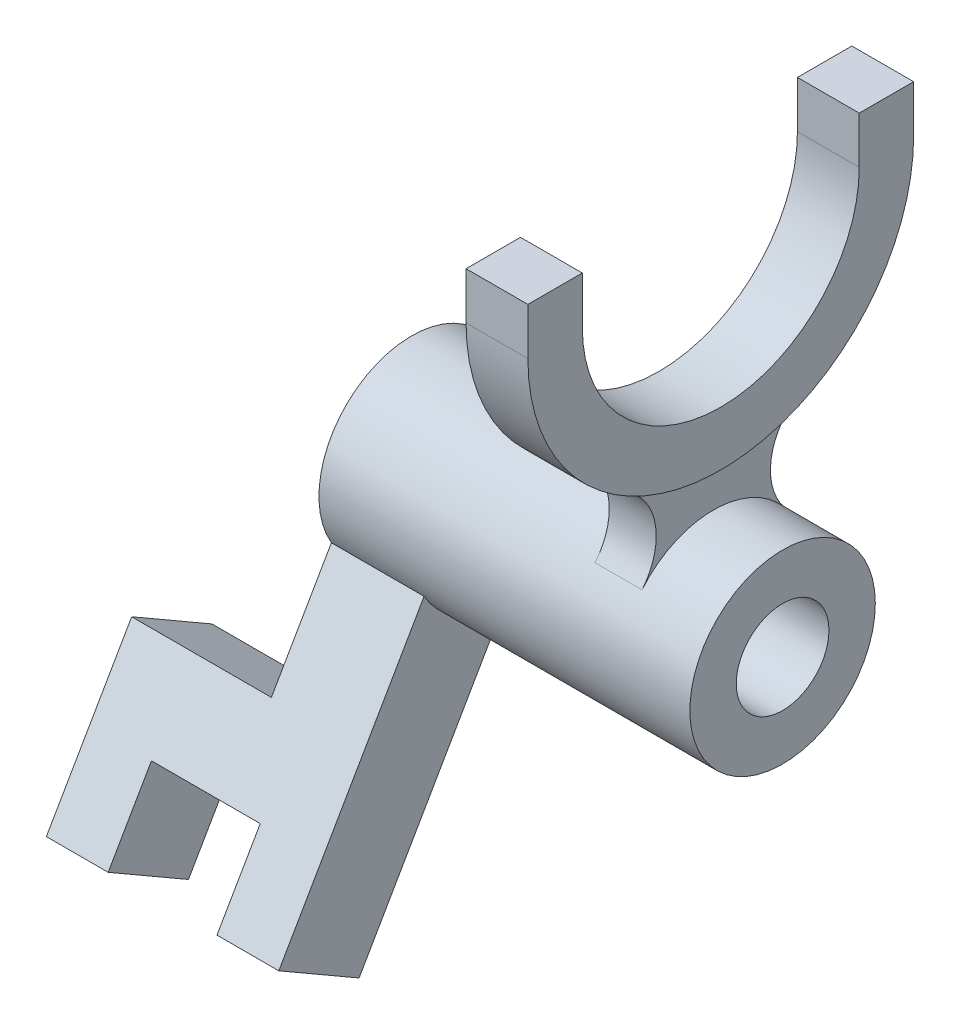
SolidWorks part; units mm, degrees
ref_plane "Front Plane" through (0, 0, 0) normal (0, 0, 1) x (1, 0, 0)
ref_plane "Top Plane" through (0, 0, 0) normal (0, 1, 0) x (1, 0, 0)
ref_plane "Right Plane" through (0, 0, 0) normal (1, 0, 0) x (0, 0, -1)
sketch "Sketch1" plane through (0, 0, 0) normal (1, 0, 0) x (0, 0, -1)
  circle A0 centre (0, 0) radius 9.525
  circle A1 centre (0, 0) radius 19.05
  dimension "D1" = 38.1
  dimension "D2" = 19.05
extrude "Boss-Extrude2" add sketch "Sketch1" along normal blind 19.05 and the other way blind 57.15
sketch "Sketch3" plane through (0, 0, 0) normal (1, 0, 0) x (0, 0, -1)
  line L0 (0, 0) -> (0, 66.548) construction
  line L1 (39.624, 66.548) -> (39.624, 76.2)
  line L2 (-39.624, 66.548) -> (-39.624, 76.2)
  arc A0 (-39.624, 66.548) -> (39.624, 66.548) centre (0, 66.548) ccw
  dimension "D2" = 39.624
  dimension "D1" = 66.548
  dimension "D3" = 9.652
extrude "Extrude-Thin1" add sketch "Sketch3" along normal mid plane 12.7 separate body thin
sketch "Sketch4" plane through (0, 0, 0) normal (1, 0, 0) x (0, 0, -1)
  arc A0 (-39.624, 66.548) -> (39.624, 66.548) centre (0, 66.548) ccw construction
  circle A1 centre (0, 0) radius 19.05 construction
  arc A2 (-18.5011, 31.5085) -> (18.5011, 31.5085) centre (0, 66.548) ccw
  arc A3 (14.6586, 12.1667) -> (-14.6586, 12.1667) centre (0, 0) ccw
  arc A4 (-14.6586, 12.1667) -> (-18.5011, 31.5085) centre (-24.431, 20.2778) ccw
  arc A5 (14.6586, 12.1667) -> (18.5011, 31.5085) centre (24.431, 20.2778) cw
  dimension "D1" = 12.7
extrude "Boss-Extrude3" add sketch "Sketch4" along normal mid plane 9.652
ref_plane "Plane1" through (0, 0, 0) normal (0, 0.5, 0.866) x (1, 0, 0)
sketch "Sketch5" plane through (0, 0, 0) normal (0, 0.5, 0.866) x (1, 0, 0)
  line L0 (-57.15, -9.525) -> (-57.15, -41.148)
  line L1 (-57.15, -41.148) -> (-85.852, -41.148)
  line L2 (-85.852, -41.148) -> (-85.852, -76.2)
  line L3 (-85.852, -76.2) -> (-73.152, -76.2)
  line L4 (-73.152, -76.2) -> (-73.152, -58.42)
  line L5 (-73.152, -58.42) -> (-50.8, -58.42)
  line L6 (-50.8, -58.42) -> (-50.8, -76.2)
  line L7 (-50.8, -76.2) -> (-38.1, -76.2)
  line L8 (-38.1, -76.2) -> (-38.1, -9.525)
  line L9 (-38.1, -9.525) -> (-57.15, -9.525)
  line L10 (-57.15, -9.525) -> (19.05, -9.525) construction
  line L12 (-57.15, 0) -> (19.05, 0) construction
  dimension "D1" = 41.148
  dimension "D2" = 35.052
  dimension "D3" = 12.7
  dimension "D4" = 22.352
  dimension "D5" = 47.752
  dimension "D6" = 17.78
  dimension "D7" = 19.05
extrude "Boss-Extrude4" add sketch "Sketch5" along normal mid plane 19.05
equation "\"A\"=1.56"
equation "\"B\"=1.5"
equation "\"C\"= 0.5"
equation "\"D\"= .75"
equation "\"D1@Sketch1\"=\"B\""
equation "\"D1@Extrude-Thin1\"=\"C\""
